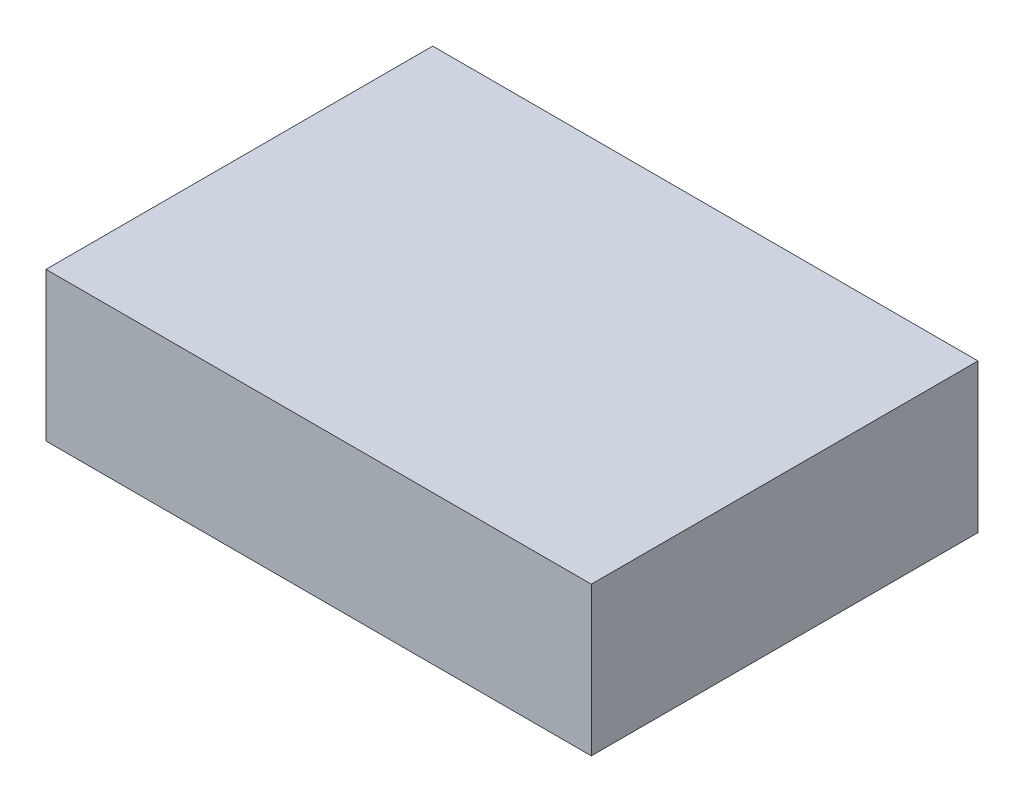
SolidWorks part; units mm, degrees
ref_plane "Front Plane" through (0, 0, 0) normal (0, 0, 1) x (1, 0, 0)
ref_plane "Top Plane" through (0, 0, 0) normal (0, 1, 0) x (1, 0, 0)
ref_plane "Right Plane" through (0, 0, 0) normal (1, 0, 0) x (0, 0, -1)
sketch "Sketch1" plane through (0, 0, 0) normal (0, 1, 0) x (1, 0, 0)
  line L1 (-27.5, 19.5) -> (27.5, 19.5)
  line L2 (-27.5, 19.5) -> (-27.5, -19.5)
  line L3 (-27.5, -19.5) -> (27.5, -19.5)
  line L4 (27.5, 19.5) -> (27.5, -19.5)
  line L5 (-27.5, 19.5) -> (27.5, -19.5) construction
  line L6 (-27.5, -19.5) -> (27.5, 19.5) construction
  point P0 (0, 0)
  dimension "D1" = 39
  dimension "D2" = 55
extrude "Boss-Extrude1" add sketch "Sketch1" along normal blind 15
